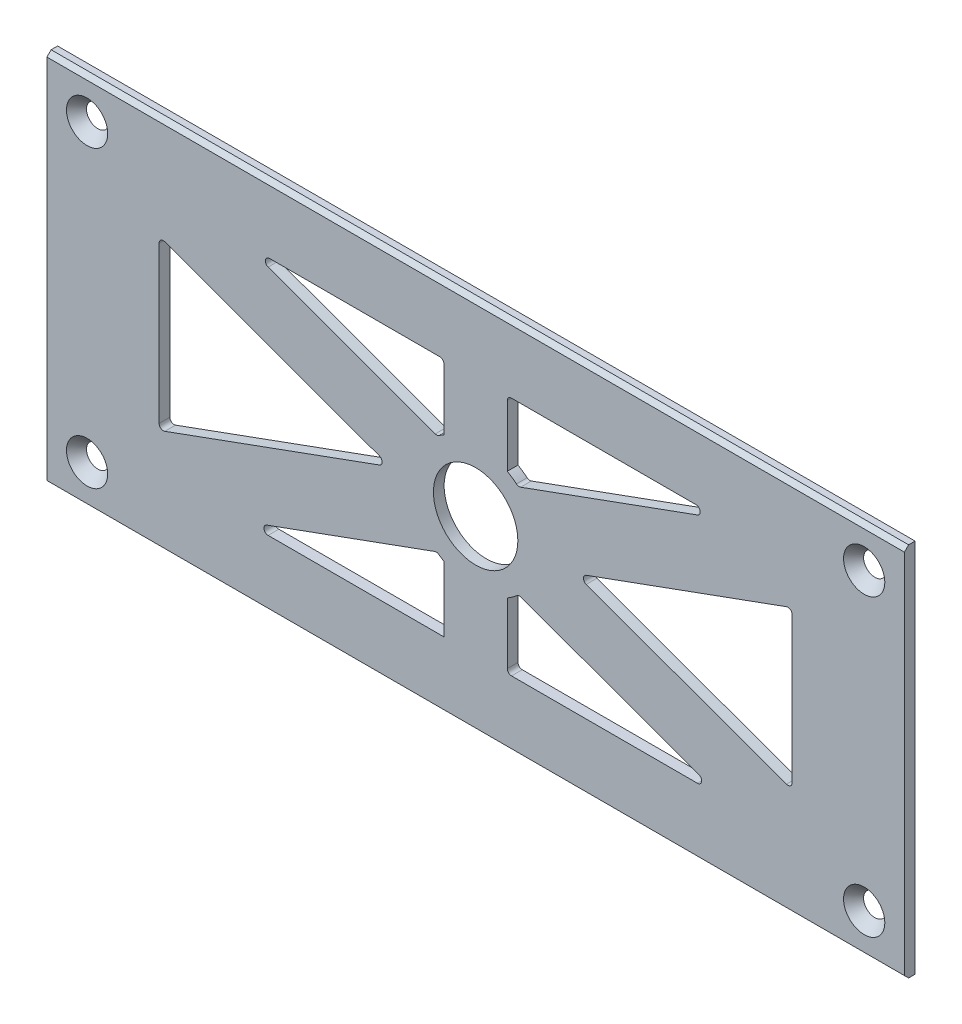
SolidWorks part; units mm, degrees
ref_plane "Front Plane" through (0, 0, 0) normal (0, 0, 1) x (1, 0, 0)
ref_plane "Top Plane" through (0, 0, 0) normal (0, 1, 0) x (1, 0, 0)
ref_plane "Right Plane" through (0, 0, 0) normal (1, 0, 0) x (0, 0, -1)
sketch "Sketch2" plane through (0, 0, 0) normal (0, 0, 1) x (1, 0, 0)
  line L1 (-101.6, -44.45) -> (101.6, -44.45)
  line L2 (-101.6, -44.45) -> (-101.6, 44.45)
  line L3 (-101.6, 44.45) -> (101.6, 44.45)
  line L4 (101.6, -44.45) -> (101.6, 44.45)
  line L5 (-101.6, -44.45) -> (101.6, 44.45) construction
  line L6 (-101.6, 44.45) -> (101.6, -44.45) construction
  circle A19 centre (0, 0) radius 10
  point P0 (0, 0)
  dimension "D6" = 20
  dimension "D2" = 88.9
  dimension "D4" = 203.2
extrude "Boss-Extrude1" add sketch "Sketch2" along normal mid plane 2.54
sketch "Sketch3" plane through (0, 0, 1.27) normal (0, 0, 1) x (1, 0, 0)
  line L0 (-101.6, 34.925) -> (-92.075, 34.925) construction
  line L1 (-101.6, 44.45) -> (-101.6, -44.45) construction
  line L2 (-92.075, 34.925) -> (-92.075, 44.45) construction
  line L3 (101.6, 44.45) -> (-101.6, 44.45) construction
  line L4 (92.075, 44.45) -> (92.075, 34.925) construction
  line L5 (92.075, 34.925) -> (101.6, 34.925) construction
  line L6 (101.6, -44.45) -> (101.6, 44.45) construction
  line L7 (92.075, -44.45) -> (92.075, -34.925) construction
  line L8 (-101.6, -44.45) -> (101.6, -44.45) construction
  line L9 (92.075, -34.925) -> (101.6, -34.925) construction
  line L10 (-92.075, -44.45) -> (-92.075, -34.925) construction
  line L11 (-92.075, -34.925) -> (-101.6, -34.925) construction
  circle A0 centre (-92.075, 34.925) radius 2.5527
  circle A1 centre (-92.075, -34.925) radius 2.5527
  circle A2 centre (92.075, -34.925) radius 2.5527
  circle A3 centre (92.075, 34.925) radius 2.5527
  dimension "D2" = 5.1054
  dimension "D1" = 9.525
extrude "Cut-Extrude1" cut sketch "Sketch3" against normal through all
hole_wizard "CSK for #10 Oval Head Machine Screw1" positions "Sketch5" profile "Sketch6" countersink size "#10" standard "ANSI Inch"
sketch "Sketch5" plane through (0, 0, 1.27) normal (0, 0, 1) x (1, 0, 0)
  point P0 (-92.075, 34.925)
  point P3 (-92.075, -34.925)
  point P6 (92.075, -34.925)
  point P9 (92.075, 34.925)
sketch "Sketch6" plane through (-92.075, 34.925, 1.27) normal (1, 0, 0) x (0, -1, 0)
  line L0 (0, 0) -> (0, 2.54)
  line L1 (0, 2.54) -> (2.5527, 2.54)
  line L2 (2.5527, 2.54) -> (2.5527, 2.6882)
  line L3 (2.5527, 2.6882) -> (4.8895, 0)
  line L5 (4.8895, 0) -> (0, 0)
  line L6 (-2.5527, 2.6882) -> (-4.8895, 0) construction
  line L11 (0, -6.35) -> (0, 107.95) construction
  dimension "Thru Hole Dia." = 5.1054
  dimension "Thru Hole Depth" = 2.54
  dimension "Near C'Sink Dia." = 9.779
  dimension "Near C'Sink Angle" = 82
sketch "Sketch7" plane through (0, 0, 1.27) normal (0, 0, 1) x (1, 0, 0)
sketch "Sketch8" plane through (0, 0, 1.27) normal (0, 0, 1) x (1, 0, 0)
  line L0 (-7.5, 12.9904) -> (-7.5, 28.5)
  line L1 (-75, -28.5) -> (75, -28.5)
  line L2 (-75, -28.5) -> (-75, 28.5)
  line L3 (-75, 28.5) -> (75, 28.5)
  line L4 (75, -28.5) -> (75, 28.5)
  line L5 (-75, -28.5) -> (75, 28.5) construction
  line L6 (-75, 28.5) -> (75, -28.5) construction
  line L7 (7.5, 12.9904) -> (7.5, 28.5)
  line L8 (-9.057, 11.9571) -> (-54.5083, 28.5)
  line L9 (-75, 19.9957) -> (-14.881, -1.8858)
  line L10 (10.1873, -11.0099) -> (58.2408, -28.5)
  line L11 (14.6239, 3.3379) -> (75, -18.6372)
  line L12 (-9.1677, -11.8723) -> (-54.8518, -28.5)
  line L13 (-14.8638, 2.0171) -> (-75, -19.8707)
  line L14 (-7.5, -12.9904) -> (-7.5, -28.5)
  line L15 (7.5, -12.9904) -> (7.5, -28.5)
  line L16 (14.6543, -3.2018) -> (75, 18.7622)
  line L17 (10.0897, 11.0995) -> (57.8973, 28.5)
  line L18 (-7.5, -20.7452) -> (7.5, -20.7452)
  line L19 (0, -20.7452) -> (0, -15) construction
  line L20 (-44.9405, 9.0549) -> (-39.8102, 23.1503) construction
  line L21 (-32.0098, -20.1862) -> (-37.1401, -6.0908) construction
  circle A0 centre (0, 0) radius 15
  point P0 (0, 0)
  point P38 (-42.3753, 16.1026)
  point P41 (-34.5749, -13.1385)
  dimension "D1" = 30
  dimension "D2" = 150
  dimension "D3" = 57
  dimension "D4" = 20
  dimension "D5" = 20
  dimension "D6" = 15
  dimension "D7" = 15
extrude "Cut-Extrude2" cut sketch "Sketch8" against normal blind 10 contours A0 L12 L1 L14 | A0 L15 L1 L10 | L16 L11 L4 | A0 L17 L3 L7 | A0 L0 L3 L8 | L13 L9 L2
fillet "Fillet1" radius 1 17 edges at (-54.8518, -28.5, 0) (7.5, -28.5, 0) (-9.1677, -11.8723, 0) (10.1873, -11.0099, 0) (58.2408, -28.5, 0) (75, -18.6372, 0) (75, 18.7622, 0) (23.623, 0.0625, 0) (57.8973, 28.5, 0) (7.5, 28.5, 0) (10.0897, 11.0995, 0) (-54.5083, 28.5, 0) (-7.5, 28.5, 0) (-9.057, 11.9571, 0) (-20.234, 0.0625, 0) (-75, -19.8707, 0) (-75, 19.9957, 0)
chamfer "Chamfer1" distance 1 angle 45 2 edges at (0, -44.45, 1.27) (0, 44.45, 1.27)
